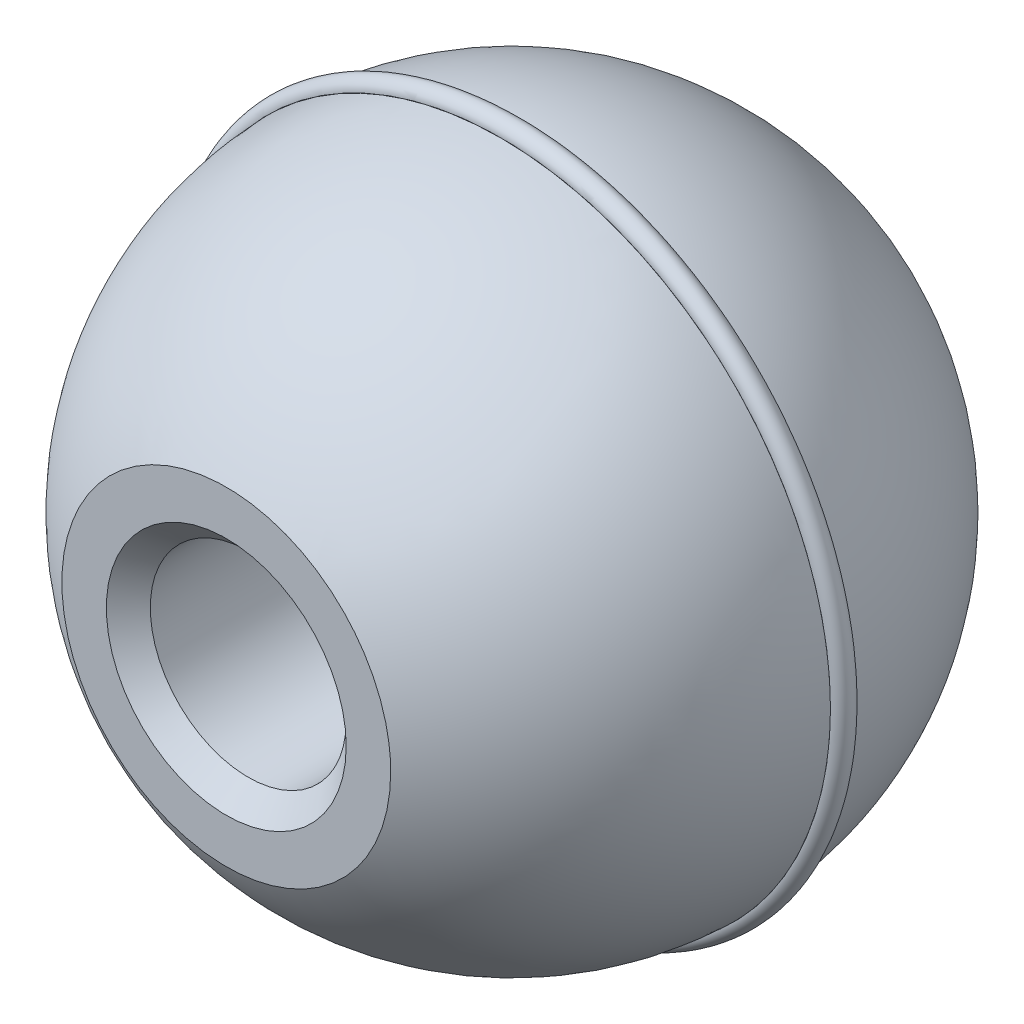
SolidWorks part; units mm, degrees
ref_plane "Спереди" through (0, 0, 0) normal (0, 0, 1) x (1, 0, 0)
ref_plane "Сверху" through (0, 0, 0) normal (0, 1, 0) x (1, 0, 0)
ref_plane "Справа" through (0, 0, 0) normal (1, 0, 0) x (0, 0, -1)
imported_body "Импортированный3"
hole_wizard "Отверстие1" positions "Эскиз2" profile "Эскиз1" legacy
sketch "Эскиз2" plane through (0, 0, 13) normal (0, 0, 1) x (1, 0, 0)
  point P0 (0, 0)
sketch "Эскиз1" plane through (0, 0, 13) normal (1, 0, 0) x (0, -1, 0)
  line L0 (0, 0) -> (0, 18)
  line L1 (0, 18) -> (4.4585, 18)
  line L2 (4.4585, 18) -> (4.4585, 0)
  line L3 (4.4585, 0) -> (0, 0)
  line L4 (0, 110) -> (0, -10) construction
  dimension "Диаметр" = 8.917
  dimension "Глубина" = 18
chamfer "Фаска1" distance 1 angle 45 2 edges at (4.4585, 0, 13) (4.4585, 0, -5)
